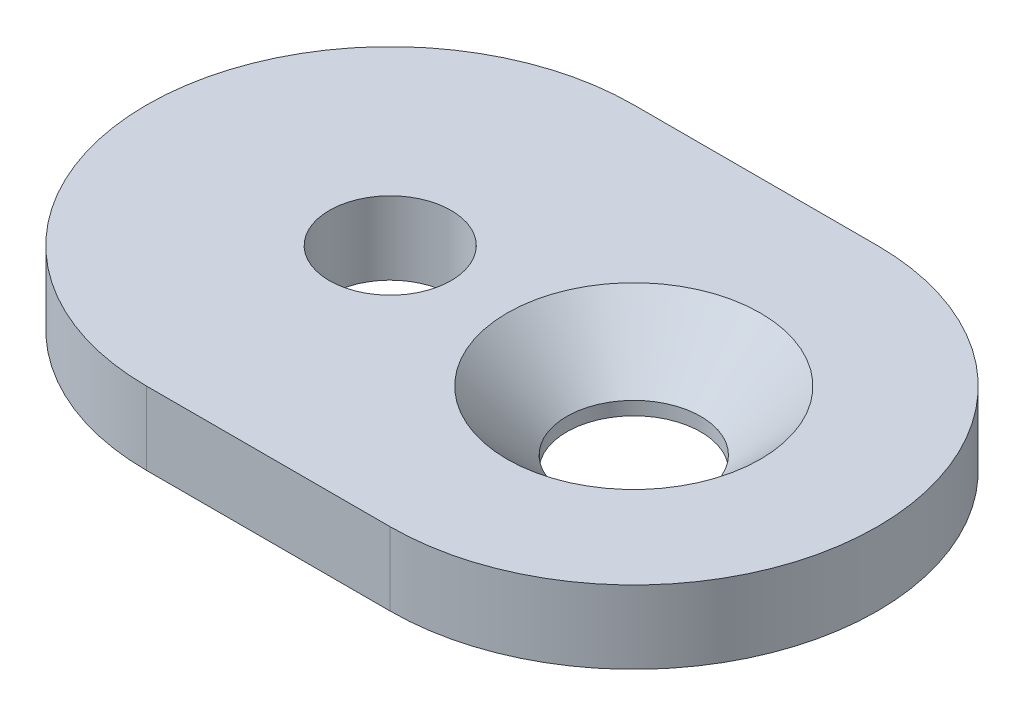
SolidWorks part; units mm, degrees
ref_plane "Front" through (0, 0, 0) normal (0, 0, 1) x (1, 0, 0)
ref_plane "Top" through (0, 0, 0) normal (0, 1, 0) x (1, 0, 0)
ref_plane "Right" through (0, 0, 0) normal (1, 0, 0) x (0, 0, -1)
sketch "Sketch1" plane through (0, 0, 0) normal (0, 1, 0) x (1, 0, 0)
  line L3 (10, 10) -> (0, 10)
  line L4 (10, -10) -> (0, -10)
  arc A1 (0, 10) -> (0, -10) centre (0, 0) ccw
  circle A2 centre (0, 0) radius 2.5
  circle A3 centre (10, 0) radius 2.5
  arc A5 (10, -10) -> (10, 10) centre (10, 0) ccw
extrude "Extrude1" add sketch "Sketch1" along normal blind 3
hole_wizard "CSK for M5 Countersunk Flat Head Screw1" positions "3DSketch1" profile "Sketch2" countersink size "M5" standard "ISO"
sketch3d "3DSketch1"
  point P0 (10, 3, 0)
sketch "Sketch2" plane through (10, 3, 0) normal (1, 0, 0) x (0, 0, 1)
  line L0 (0, 0) -> (0, 3)
  line L1 (0, 3) -> (2.75, 3)
  line L2 (2.75, 3) -> (2.75, 2.45)
  line L3 (2.75, 2.45) -> (5.2, 0)
  line L5 (5.2, 0) -> (0, 0)
  line L6 (-2.75, 2.45) -> (-5.2, 0) construction
  line L11 (0, -6.35) -> (0, 107.95) construction
  dimension "Thru Hole Dia." = 5.5
  dimension "Thru Hole Depth" = 3
  dimension "Near C'Sink Dia." = 10.4
  dimension "Near C'Sink Angle" = 90
